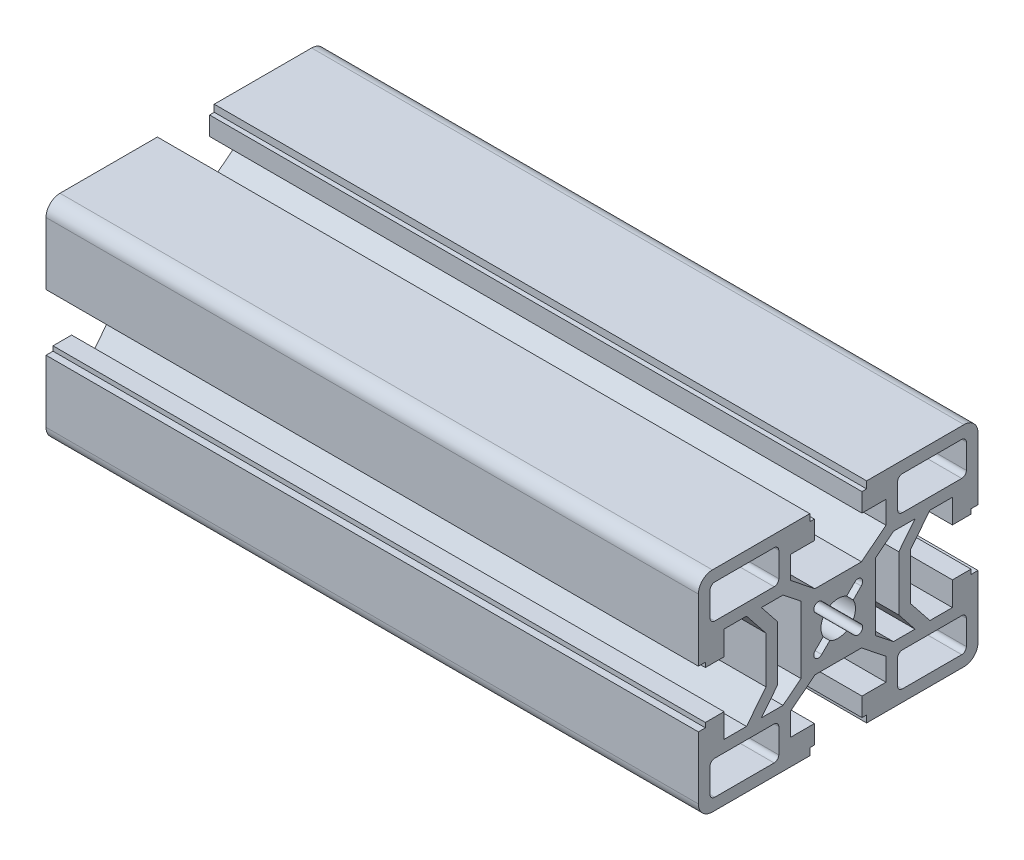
SolidWorks part; units mm, degrees
ref_plane "Plan de face" through (0, 0, 0) normal (0, 0, 1) x (1, 0, 0)
ref_plane "Plan de dessus" through (0, 0, 0) normal (0, 1, 0) x (1, 0, 0)
ref_plane "Plan de droite" through (0, 0, 0) normal (1, 0, 0) x (0, 0, -1)
sketch "Esquisse2"
extrude "Boss.-Extru.2" add sketch "Esquisse2" along normal blind 140
equation "\"D8@Esquisse2\"=\"D3@Esquisse2\""
equation "\"D9@Esquisse2\"=\"D4@Esquisse2\""
equation "\"D12@Esquisse2\"=\"D13@Esquisse2\""
equation "\"D14@Esquisse2\"=\"D15@Esquisse2\""
equation "\"D16@Esquisse2\"=\"D17@Esquisse2\""
equation "\"D18@Esquisse2\"=\"D17@Esquisse2\""
equation "\"D19@Esquisse2\"=\"D17@Esquisse2\""
equation "\"D6@Esquisse2\"=\"D17@Esquisse2\""
equation "\"D5@Esquisse2\"=\"D17@Esquisse2\""
equation "\"D21@Esquisse2\"=\"D20@Esquisse2\""
equation "\"D23@Esquisse2\"=\"D22@Esquisse2\""
equation "\"D24@Esquisse2\"=\"D17@Esquisse2\""
